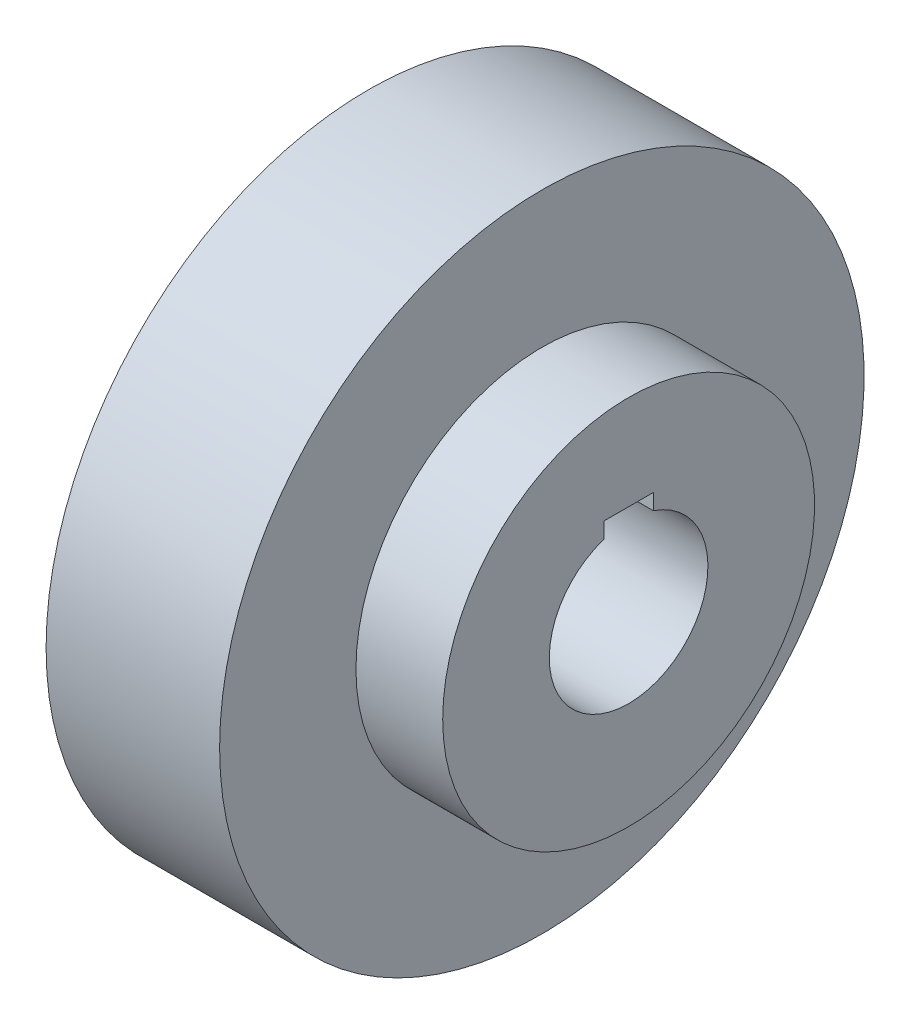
SolidWorks part; units mm, degrees
ref_plane "Plan1" through (0, 0, 0) normal (0, 0, 1) x (1, 0, 0)
ref_plane "Plan2" through (0, 0, 0) normal (0, 1, 0) x (1, 0, 0)
ref_plane "Plan3" through (0, 0, 0) normal (1, 0, 0) x (0, 0, -1)
sketch "Esquisse1" plane through (0, 0, 0) normal (0, 0, 1) x (1, 0, 0)
  line L0 (-48.7841, 0) -> (-29.9357, 0) construction
  line L2 (-35, 37.5) -> (-17.5, 37.5)
  line L3 (-17.5, 37.5) -> (-17.5, 65)
  line L4 (-17.5, 65) -> (17.5, 65)
  line L5 (-35, 16) -> (-35, 37.5)
  line L6 (-35, 16) -> (35, 16)
  line L7 (35, 16) -> (35, 37.5)
  line L8 (17.5, 37.5) -> (17.5, 65)
  line L9 (35, 37.5) -> (17.5, 37.5)
  point P12 (0, 16)
  point P14 (0, 65)
  dimension "D1" = 65
  dimension "D2" = 37.5
  dimension "D3" = 16
  dimension "D4" = 35
  dimension "D5" = 17.5
revolve "Base-Révolution" add sketch "Esquisse1" angle 360 about L0
sketch "Esquisse2" plane through (0, 0, 0) normal (1, 0, 0) x (0, 0, -1)
  line L0 (5, 18.4) -> (5, 13.4652)
  line L1 (5, 18.4) -> (-5, 18.4)
  line L2 (-5, 18.4) -> (-5, 13.4652)
  line L3 (5, 13.4652) -> (-5, 13.4652)
  dimension "D1" = 18.4
  dimension "D2" = 5
  dimension "D3" = 10
extrude "Enlèv. mat.-Extru.1" cut sketch "Esquisse2" against normal mid plane 78
